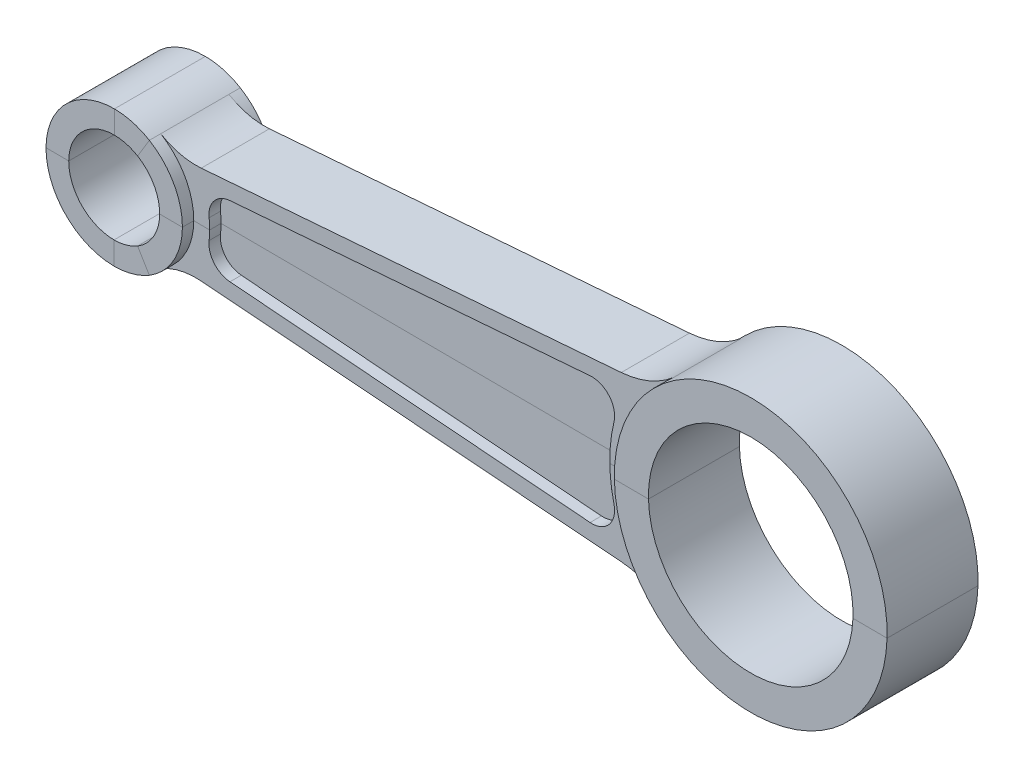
SolidWorks part; units mm, degrees
ref_plane "Front Plane" through (0, 0, 0) normal (0, 0, 1) x (1, 0, 0)
ref_plane "Top Plane" through (0, 0, 0) normal (0, 1, 0) x (1, 0, 0)
ref_plane "Right Plane" through (0, 0, 0) normal (1, 0, 0) x (0, 0, -1)
sketch "Sketch1" plane through (0, 0, 0) normal (0, 1, 0) x (1, 0, 0)
  line L0 (38.1, 25.4) -> (0, 25.4)
  line L1 (0, 25.4) -> (0, 19.05)
  line L2 (0, 19.05) -> (38.1, 19.05)
  line L3 (38.1, 19.05) -> (38.1, 25.4)
  line L4 (0, 25.4) -> (0, 19.05) construction
revolve "Revolve1" add sketch "Sketch1" angle 360 about L4
sketch "Sketch2" plane through (0, 0, -19.05) normal (0, 0, 1) x (1, 0, 0)
  line L0 (295.8347, -47.271) -> (42.2666, -27.3147)
  line L1 (42.2666, 27.3147) -> (295.8347, 47.271)
  arc A0 (295.8347, 47.271) -> (295.8347, -47.271) centre (355.6, 0) cw
  arc A1 (42.2666, -27.3147) -> (19.6386, -32.6486) centre (39.2773, -65.2973) ccw
  arc A2 (19.6386, -32.6486) -> (19.6386, 32.6486) centre (0, 0) cw
  arc A3 (19.6386, 32.6486) -> (42.2666, 27.3147) centre (39.2773, 65.2973) ccw
extrude "Boss-Extrude1" add sketch "Sketch2" along normal blind 44.45
sketch "Sketch3" plane through (0, 0, 25.4) normal (0, 0, 1) x (1, 0, 0)
  line L0 (42.2666, -27.3147) -> (295.8347, -47.271)
  line L1 (295.8347, 47.271) -> (42.2666, 27.3147)
  arc A0 (295.8347, -47.271) -> (295.8347, 47.271) centre (355.6, 0) cw
  arc A1 (42.2666, 27.3147) -> (19.6386, 32.6486) centre (39.2773, 65.2973) cw
  arc A2 (19.6386, 32.6486) -> (19.6386, -32.6486) centre (0, 0) cw
  arc A3 (19.6386, -32.6486) -> (42.2666, -27.3147) centre (39.2773, -65.2973) cw
extrude "Cut-Extrude1" cut sketch "Sketch3" against normal blind 6.35
sketch "Sketch4" plane through (0, 0, -19.05) normal (0, 0, -1) x (-1, 0, 0)
  circle A0 centre (-355.6, 0) radius 76.2
extrude "Boss-Extrude2" add sketch "Sketch4" along normal blind 6.35
sketch "Sketch5" plane through (0, 0, -19.05) normal (0, 0, -1) x (-1, 0, 0)
  line L0 (-43.2073, 18.4713) -> (-259.5169, 35.4952)
  line L1 (-259.5169, -35.4952) -> (-43.2073, -18.4713)
  arc A0 (-43.2073, -18.4713) -> (-43.2073, 18.4713) centre (0, 0) cw
  arc A1 (-259.5169, 35.4952) -> (-272.8622, 19.8689) centre (-260.5133, 22.8344) ccw
  arc A2 (-272.8622, 19.8689) -> (-272.8622, -19.8689) centre (-355.6, 0) cw
  arc A3 (-272.8622, -19.8689) -> (-259.5169, -35.4952) centre (-260.5133, -22.8344) ccw
extrude "Cut-Extrude2" cut sketch "Sketch5" against normal blind 6.35
sketch "Sketch6" plane through (0, 0, 19.05) normal (0, 0, 1) x (1, 0, 0)
  line L0 (259.5169, 35.4952) -> (43.2073, 18.4713)
  line L1 (43.2073, -18.4713) -> (259.5169, -35.4952)
  arc A0 (43.2073, 18.4713) -> (43.2073, -18.4713) centre (0, 0) cw
  arc A1 (259.5169, -35.4952) -> (272.8622, -19.8689) centre (260.5133, -22.8344) ccw
  arc A2 (272.8622, -19.8689) -> (272.8622, 19.8689) centre (355.6, 0) cw
  arc A3 (272.8622, 19.8689) -> (259.5169, 35.4952) centre (260.5133, 22.8344) ccw
extrude "Cut-Extrude3" cut sketch "Sketch6" against normal blind 6.35
hole_wizard "Hole1" positions "Sketch8" profile "Sketch7" legacy
sketch "Sketch8" plane through (0, 0, 25.4) normal (0, 0, 1) x (1, 0, 0)
  point P0 (355.6, 0)
sketch "Sketch7" plane through (355.6, 0, 25.4) normal (1, 0, 0) x (0, -1, 0)
  line L0 (0, 0) -> (0, 50.8)
  line L1 (0, 50.8) -> (57.15, 50.8)
  line L2 (57.15, 50.8) -> (57.15, 0)
  line L3 (57.15, 0) -> (0, 0)
  line L4 (0, 110) -> (0, -10) construction
  dimension "Diameter" = 114.3
  dimension "Depth" = 50.8
hole_wizard "Hole2" positions "Sketch10" profile "Sketch9" legacy
sketch "Sketch10" plane through (0, 0, 25.4) normal (0, 0, 1) x (1, 0, 0)
  point P0 (0, 0)
sketch "Sketch9" plane through (0, 0, 25.4) normal (1, 0, 0) x (0, -1, 0)
  line L0 (0, 0) -> (0, 50.8)
  line L1 (0, 50.8) -> (25.4, 50.8)
  line L2 (25.4, 50.8) -> (25.4, 0)
  line L3 (25.4, 0) -> (0, 0)
  line L4 (0, 110) -> (0, -10) construction
  dimension "Diameter" = 50.8
  dimension "Depth" = 50.8
fillet "Fillet1" radius 12.7 4 edges at (43.2073, 18.4713, 15.875) (43.2073, -18.4713, 15.875) (43.2073, 18.4713, -15.875) (43.2073, -18.4713, -15.875)
fillet "Fillet2" radius 50.8 2 edges at (295.8347, -47.271, 0) (295.8347, 47.271, 0)
sketch "Sketch11" plane through (0, 0, 25.4) normal (0, 0, 1) x (1, 0, 0)
  line L0 (0, 0) -> (0.2425, 70.8754)
  line L1 (0, 0) -> (-0.1925, -56.2477)
  point P0 (0, 0)
sketch "Sketch12" plane through (0, 0, 25.4) normal (0, 0, 1) x (1, 0, 0)
  line L0 (0, 0) -> (26.9831, 44.8586)
  line L1 (0, 0) -> (34.612, -57.5414)
  line L2 (0, 0) -> (0.15, 44.3977) construction
  line L3 (0, 0) -> (-0.203, -60.1108) construction
  arc A0 (42.2666, -27.3147) -> (19.6386, -32.6486) centre (39.2773, -65.2973) ccw construction
  arc A1 (19.6386, 32.6486) -> (42.2666, 27.3147) centre (39.2773, 65.2973) ccw construction
  arc A2 (42.2666, -27.3147) -> (19.6386, -32.6486) centre (39.2773, -65.2973) ccw construction
  arc A3 (19.6386, 32.6486) -> (42.2666, 27.3147) centre (39.2773, 65.2973) ccw construction
  point P0 (0, 0)
sketch "Sketch13" plane through (0, 0, 25.4) normal (0, 0, 1) x (1, 0, 0)
  line L0 (0, 0) -> (481.9215, -2.4328)
  line L1 (0, 0) -> (-73.6294, 0.3717)
  point P0 (0, 0)
